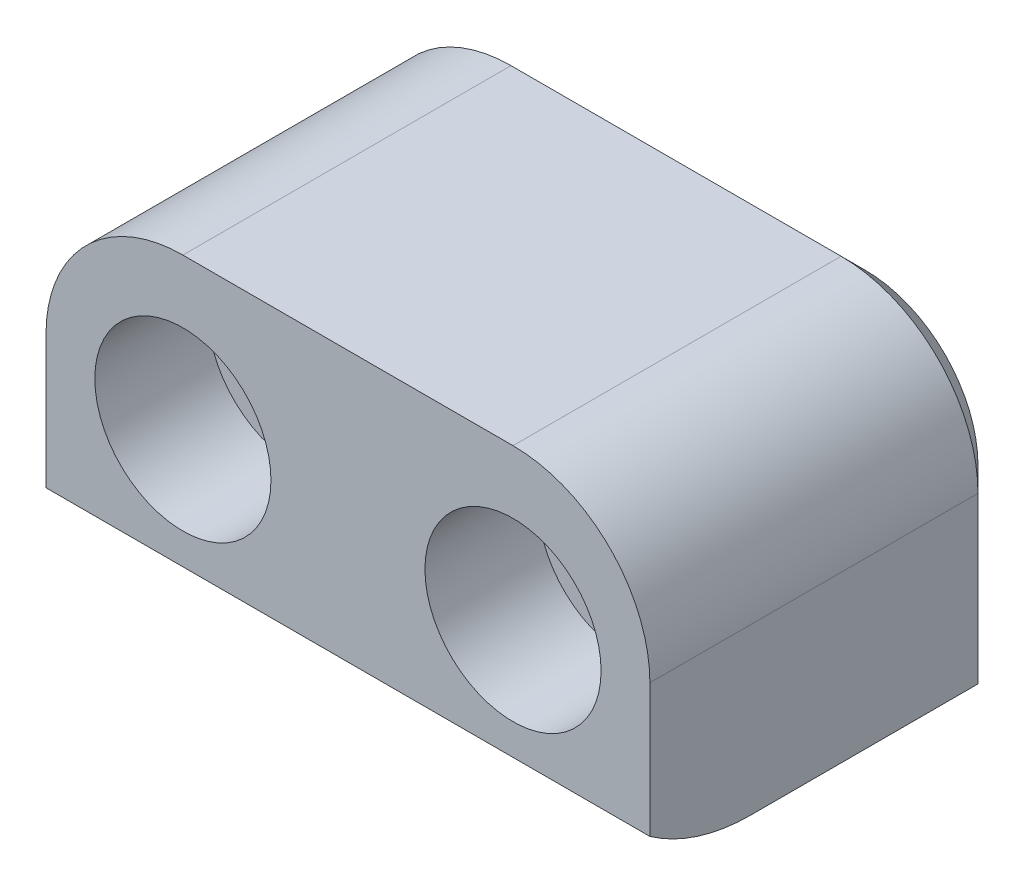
SolidWorks part; units mm, degrees
ref_plane "Front Plane" through (0, 0, 0) normal (0, 0, 1) x (1, 0, 0)
ref_plane "Top Plane" through (0, 0, 0) normal (0, 1, 0) x (1, 0, 0)
ref_plane "Right Plane" through (0, 0, 0) normal (1, 0, 0) x (0, 0, -1)
sketch "Sketch3" plane through (0, 0, 0) normal (0, 0, 1) x (1, 0, 0)
  line L0 (0, -10.4775) -> (0, 10.4775) construction
  line L1 (0, 19.05) -> (38.1, 19.05)
  line L2 (0, 19.05) -> (0, 0)
  line L3 (0, 0) -> (38.1, 0)
  line L4 (38.1, 19.05) -> (38.1, 0)
  dimension "D1" = 19.05
  dimension "D2" = 38.1
extrude "Extrude1" add sketch "Sketch3" against normal blind 22.225
fillet "Fillet1" radius 8.636 2 edges at (38.1, 19.05, -11.1125) (0, 19.05, -11.1125)
hole_wizard "1/4\"-20 CBORE" positions "Sketch7" profile "Sketch6" counterbore size "1/4" standard "Ansi Inch"
sketch "Sketch7" plane through (0, 0, 0) normal (0, 0, 1) x (1, 0, 0)
  line L1 (-2.0915, 9.525) -> (49997.9085, 9.525) construction
  line L2 (29.464, 19.05) -> (8.636, 19.05) construction
  line L3 (0, 0) -> (38.1, 0) construction
  line L4 (0, 10.414) -> (0, 0) construction
  line L5 (38.1, 0) -> (38.1, 10.414) construction
  point P0 (8.636, 9.525)
  point P1 (29.464, 9.525)
  dimension "D1" = 8.636
  dimension "D2" = 8.636
sketch "Sketch6" plane through (8.636, 9.525, 0) normal (1, 0, 0) x (0, -1, 0)
  line L0 (0, 0) -> (0, 22.225)
  line L1 (0, 22.225) -> (3.2639, 22.225)
  line L3 (3.2639, 22.225) -> (3.2639, 7.145)
  line L4 (3.2639, 7.145) -> (5.5562, 7.145)
  line L5 (5.5562, 7.145) -> (5.5562, 0)
  line L7 (5.5562, 0) -> (0, 0)
  line L11 (0, -6.35) -> (0, 107.95) construction
  dimension "Thru Hole Dia." = 6.5278
  dimension "Thru Hole Depth" = 22.225
  dimension "C'Bore Dia." = 11.1125
  dimension "C'Bore Depth" = 7.145
sketch "Sketch8" plane through (0, 0, 0) normal (-1, 0, 0) x (0, 0, 1)
  line L0 (0, 2.0168) -> (12.7, 2.0168)
  line L1 (12.7, 2.0168) -> (12.7, -10.6832)
  line L2 (-6.35, -10.6832) -> (-6.35, 0)
  line L3 (12.7, -10.6832) -> (-6.35, -10.6832)
  line L4 (-22.225, 0) -> (0, 0) construction
  line L13 (-22.225, 0) -> (0, 0) construction
  line L14 (0, 10.414) -> (0, 0) construction
  arc A0 (-6.35, 0) -> (0, 2.0168) centre (-6.35, 11.005) ccw
  arc A2 (-1.216, 0.5243) -> (0, 2.0168) centre (-1.524, 2.0168) ccw construction
  arc A3 (-6.35, 0) -> (-1.216, 0.5243) centre (-6.35, 25.4) ccw construction
  dimension "D1" = 25.4
  dimension "D2" = 1.524
  dimension "D3" = 6.35
  dimension "D4" = 12.7
  dimension "D5" = 12.7
extrude "Cut-Extrude1" cut sketch "Sketch8" against normal through all
chamfer "Chamfer1" distance 1.524 angle 45 5 edges at (19.05, 19.05, -22.225) (38.1, 5.207, -22.225) (35.5706, 16.5206, -22.225) (0, 5.207, -22.225) (2.5294, 16.5206, -22.225)
